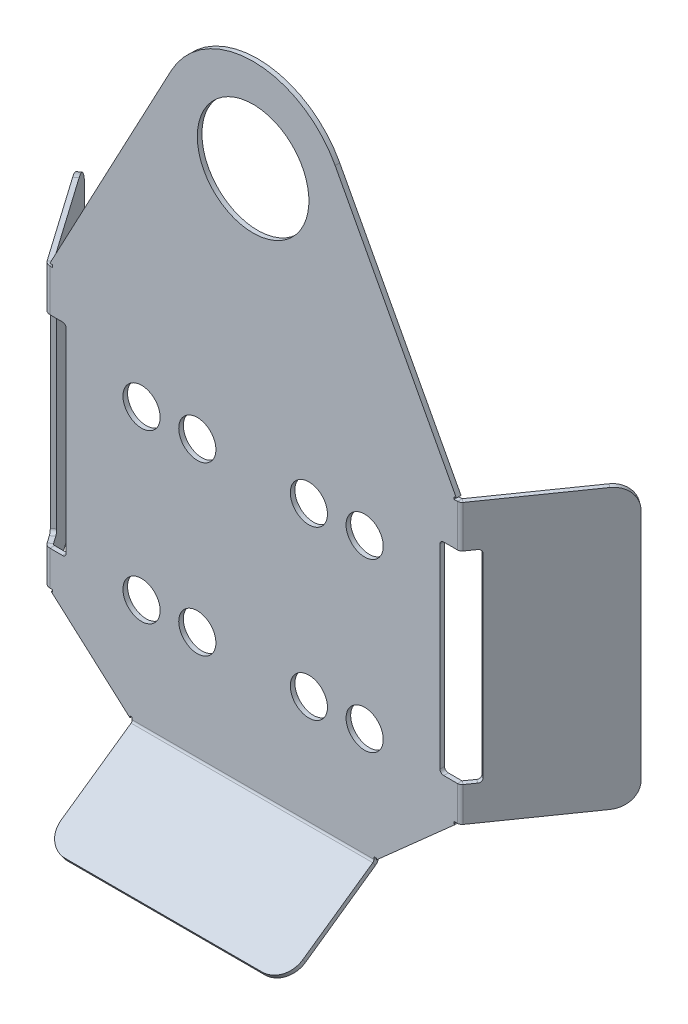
SolidWorks part; units mm, degrees
ref_plane "Front Plane" through (0, 0, 0) normal (0, 0, 1) x (1, 0, 0)
ref_plane "Top Plane" through (0, 0, 0) normal (0, 1, 0) x (1, 0, 0)
ref_plane "Right Plane" through (0, 0, 0) normal (1, 0, 0) x (0, 0, -1)
ref_plane "Plane1" through (0, 0, -1.2366) normal (0, 0, -1) x (-1, 0, 0)
sketch "Sketch7" plane through (0, 0, -1.2366) normal (0, 0, -1) x (-1, 0, 0)
  line L0 (-83.89, -54.5529) -> (-53.9983, -54.5529)
  line L1 (-53.9983, -54.5529) -> (-53.9983, -55.1712)
  line L2 (-53.9983, -55.1712) -> (-54.3044, -55.1712)
  line L3 (-54.3044, -55.1712) -> (-33.1183, -74.0033)
  line L4 (-33.1183, -74.0033) -> (-33.1183, -73.5511)
  line L5 (-33.1183, -73.5511) -> (-32.5, -73.5511)
  line L6 (-32.5, -73.5511) -> (-32.5, -98.4429)
  line L7 (-26.5, -104.4429) -> (26.5, -104.4429)
  line L8 (32.5, -98.4429) -> (32.5, -73.5511)
  line L9 (32.5, -73.5511) -> (33.1183, -73.5511)
  line L10 (33.1183, -73.5511) -> (33.1183, -74.0033)
  line L11 (33.1183, -74.0033) -> (54.3044, -55.1712)
  line L12 (54.3044, -55.1712) -> (53.9983, -55.1712)
  line L13 (53.9983, -55.1712) -> (53.9983, -54.5529)
  line L14 (53.9983, -54.5529) -> (83.89, -54.5529)
  line L15 (89.89, -48.5529) -> (89.89, 14.4471)
  line L16 (83.89, 20.4471) -> (53.9983, 20.4471)
  line L17 (53.9983, 20.4471) -> (53.9983, 21.0654)
  line L18 (53.9983, 21.0654) -> (54.6702, 21.0654)
  line L19 (54.6702, 21.0654) -> (22.0588, 82.2118)
  line L20 (-22.0588, 82.2118) -> (-54.6702, 21.0654)
  line L21 (-54.6702, 21.0654) -> (-53.9983, 21.0654)
  line L22 (-53.9983, 21.0654) -> (-53.9983, 20.4471)
  line L23 (-53.9983, 20.4471) -> (-83.89, 20.4471)
  line L24 (-89.89, 14.4471) -> (-89.89, -48.5529)
  arc A0 (-89.89, -48.5529) -> (-83.89, -54.5529) centre (-83.89, -48.5529) ccw
  arc A1 (-32.5, -98.4429) -> (-26.5, -104.4429) centre (-26.5, -98.4429) ccw
  arc A2 (26.5, -104.4429) -> (32.5, -98.4429) centre (26.5, -98.4429) ccw
  arc A3 (83.89, -54.5529) -> (89.89, -48.5529) centre (83.89, -48.5529) ccw
  arc A4 (89.89, 14.4471) -> (83.89, 20.4471) centre (83.89, 14.4471) ccw
  arc A5 (22.0588, 82.2118) -> (-22.0588, 82.2118) centre (0, 70.4471) ccw
  arc A6 (-83.89, 20.4471) -> (-89.89, 14.4471) centre (-83.89, 14.4471) ccw
sheet metal parameters "Sheet-Metal3" thickness 1.2366 parameters "D1"=0
base flange "Base-Flange1" sketch "Sketch7" thickness 1.2366 reverse thickness direction yes parameters "D1"=0
sketch "Sketch9" plane through (0, 0, -1.2366) normal (0, 0, -1) x (-1, 0, 0)
  line L0 (-50.2548, -44.2608) -> (-50.2548, 8.1212)
  line L1 (-51.2548, 9.1212) -> (-58.3864, 9.1212)
  line L2 (-59.3864, 8.1212) -> (-59.3864, -44.2608)
  line L3 (-58.3864, -45.2608) -> (-51.2548, -45.2608)
  arc A0 (-51.2548, -45.2608) -> (-50.2548, -44.2608) centre (-51.2548, -44.2608) ccw
  arc A1 (-50.2548, 8.1212) -> (-51.2548, 9.1212) centre (-51.2548, 8.1212) ccw
  arc A2 (-58.3864, 9.1212) -> (-59.3864, 8.1212) centre (-58.3864, 8.1212) ccw
  arc A3 (-59.3864, -44.2608) -> (-58.3864, -45.2608) centre (-58.3864, -44.2608) ccw
extrude "Cut-Extrude1" cut sketch "Sketch9" against normal through all
sketch "Sketch10" plane through (0, 0, 0) normal (0, 0, 1) x (1, 0, 0)
  line L0 (-50.2548, -44.2608) -> (-50.2548, 8.1212)
  line L1 (-51.2548, 9.1212) -> (-58.3864, 9.1212)
  line L2 (-59.3864, 8.1212) -> (-59.3864, -44.2608)
  line L3 (-58.3864, -45.2608) -> (-51.2548, -45.2608)
  arc A0 (-51.2548, -45.2608) -> (-50.2548, -44.2608) centre (-51.2548, -44.2608) ccw
  arc A1 (-50.2548, 8.1212) -> (-51.2548, 9.1212) centre (-51.2548, 8.1212) ccw
  arc A2 (-58.3864, 9.1212) -> (-59.3864, 8.1212) centre (-58.3864, 8.1212) ccw
  arc A3 (-59.3864, -44.2608) -> (-58.3864, -45.2608) centre (-58.3864, -44.2608) ccw
extrude "Cut-Extrude2" cut sketch "Sketch10" against normal through all
hole_wizard "Hole1" positions "Sketch12" profile "Sketch11" legacy
sketch "Sketch12" plane through (0, 0, -1.2366) normal (0, 0, -1) x (-1, 0, 0)
  point P0 (0, 70.4471)
sketch "Sketch11" plane through (0, 70.4471, -1.2366) normal (1, 0, 0) x (0, 1, 0)
  line L0 (0, 0) -> (0, 1.2366)
  line L1 (0, 1.2366) -> (15, 1.2366)
  line L2 (15, 1.2366) -> (15, 0)
  line L3 (15, 0) -> (0, 0)
  line L4 (0, 110) -> (0, -10) construction
  dimension "Diameter" = 30
  dimension "Depth" = 1.2366
hole_wizard "Hole2" positions "Sketch14" profile "Sketch13" legacy
sketch "Sketch14" plane through (0, 0, -1.2366) normal (0, 0, -1) x (-1, 0, 0)
  point P0 (-30, 0)
sketch "Sketch13" plane through (30, 0, -1.2366) normal (1, 0, 0) x (0, 1, 0)
  line L0 (0, 0) -> (0, 1.2366)
  line L1 (0, 1.2366) -> (5, 1.2366)
  line L2 (5, 1.2366) -> (5, 0)
  line L3 (5, 0) -> (0, 0)
  line L4 (0, 110) -> (0, -10) construction
  dimension "Diameter" = 10
  dimension "Depth" = 1.2366
hole_wizard "Hole3" positions "Sketch16" profile "Sketch15" legacy
sketch "Sketch16" plane through (0, 0, -1.2366) normal (0, 0, -1) x (-1, 0, 0)
  point P0 (-30, -45)
sketch "Sketch15" plane through (30, -45, -1.2366) normal (1, 0, 0) x (0, 1, 0)
  line L0 (0, 0) -> (0, 1.2366)
  line L1 (0, 1.2366) -> (5, 1.2366)
  line L2 (5, 1.2366) -> (5, 0)
  line L3 (5, 0) -> (0, 0)
  line L4 (0, 110) -> (0, -10) construction
  dimension "Diameter" = 10
  dimension "Depth" = 1.2366
hole_wizard "Hole4" positions "Sketch18" profile "Sketch17" legacy
sketch "Sketch18" plane through (0, 0, -1.2366) normal (0, 0, -1) x (-1, 0, 0)
  point P0 (-15, 0)
sketch "Sketch17" plane through (15, 0, -1.2366) normal (1, 0, 0) x (0, 1, 0)
  line L0 (0, 0) -> (0, 1.2366)
  line L1 (0, 1.2366) -> (5, 1.2366)
  line L2 (5, 1.2366) -> (5, 0)
  line L3 (5, 0) -> (0, 0)
  line L4 (0, 110) -> (0, -10) construction
  dimension "Diameter" = 10
  dimension "Depth" = 1.2366
hole_wizard "Hole5" positions "Sketch20" profile "Sketch19" legacy
sketch "Sketch20" plane through (0, 0, -1.2366) normal (0, 0, -1) x (-1, 0, 0)
  point P0 (-15, -45)
sketch "Sketch19" plane through (15, -45, -1.2366) normal (1, 0, 0) x (0, 1, 0)
  line L0 (0, 0) -> (0, 1.2366)
  line L1 (0, 1.2366) -> (5, 1.2366)
  line L2 (5, 1.2366) -> (5, 0)
  line L3 (5, 0) -> (0, 0)
  line L4 (0, 110) -> (0, -10) construction
  dimension "Diameter" = 10
  dimension "Depth" = 1.2366
hole_wizard "Hole6" positions "Sketch22" profile "Sketch21" legacy
sketch "Sketch22" plane through (0, 0, -1.2366) normal (0, 0, -1) x (-1, 0, 0)
  point P0 (15, 0)
sketch "Sketch21" plane through (-15, 0, -1.2366) normal (1, 0, 0) x (0, 1, 0)
  line L0 (0, 0) -> (0, 1.2366)
  line L1 (0, 1.2366) -> (5, 1.2366)
  line L2 (5, 1.2366) -> (5, 0)
  line L3 (5, 0) -> (0, 0)
  line L4 (0, 110) -> (0, -10) construction
  dimension "Diameter" = 10
  dimension "Depth" = 1.2366
hole_wizard "Hole7" positions "Sketch24" profile "Sketch23" legacy
sketch "Sketch24" plane through (0, 0, -1.2366) normal (0, 0, -1) x (-1, 0, 0)
  point P0 (15, -45)
sketch "Sketch23" plane through (-15, -45, -1.2366) normal (1, 0, 0) x (0, 1, 0)
  line L0 (0, 0) -> (0, 1.2366)
  line L1 (0, 1.2366) -> (5, 1.2366)
  line L2 (5, 1.2366) -> (5, 0)
  line L3 (5, 0) -> (0, 0)
  line L4 (0, 110) -> (0, -10) construction
  dimension "Diameter" = 10
  dimension "Depth" = 1.2366
hole_wizard "Hole8" positions "Sketch26" profile "Sketch25" legacy
sketch "Sketch26" plane through (0, 0, -1.2366) normal (0, 0, -1) x (-1, 0, 0)
  point P0 (30, 0)
sketch "Sketch25" plane through (-30, 0, -1.2366) normal (1, 0, 0) x (0, 1, 0)
  line L0 (0, 0) -> (0, 1.2366)
  line L1 (0, 1.2366) -> (5, 1.2366)
  line L2 (5, 1.2366) -> (5, 0)
  line L3 (5, 0) -> (0, 0)
  line L4 (0, 110) -> (0, -10) construction
  dimension "Diameter" = 10
  dimension "Depth" = 1.2366
hole_wizard "Hole9" positions "Sketch28" profile "Sketch27" legacy
sketch "Sketch28" plane through (0, 0, -1.2366) normal (0, 0, -1) x (-1, 0, 0)
  point P0 (30, -45)
sketch "Sketch27" plane through (-30, -45, -1.2366) normal (1, 0, 0) x (0, 1, 0)
  line L0 (0, 0) -> (0, 1.2366)
  line L1 (0, 1.2366) -> (5, 1.2366)
  line L2 (5, 1.2366) -> (5, 0)
  line L3 (5, 0) -> (0, 0)
  line L4 (0, 110) -> (0, -10) construction
  dimension "Diameter" = 10
  dimension "Depth" = 1.2366
sketch "Sketch29" plane through (0, 0, 0) normal (0, 0, 1) x (1, 0, 0)
  line L0 (-55.2669, -54.5529) -> (-55.2669, 20.4471)
sketched bend "Sketched Bend1" parameters "D1"=0.7366
bend "SketchBend1" bend radius 0.7366 bend angle 55 parameters "D5"=1
sketch "Sketch30" plane through (0, 0, 0) normal (0, 0, 1) x (1, 0, 0)
  line L2 (55.2669, -54.5529) -> (55.2669, 20.4471)
sketched bend "Sketched Bend2" parameters "D1"=0
bend "SketchBend4" bend radius 0 bend angle 55 parameters "D5"=2
sketch "Sketch31" plane through (0, 0, 0) normal (0, 0, 1) x (1, 0, 0)
  line L0 (-32.5, -74.8197) -> (32.5, -74.8197)
sketched bend "Sketched Bend3" parameters "D1"=0.7366
bend "SketchBend3" bend radius 0.7366 bend angle 55 parameters "D5"=3
flat pattern "Flat-Pattern3"
sketch "Bend-Lines3" plane through (0, 0, 0) normal (0, 0, 1) x (1, 0, 0)
  line L0 (-32.5, -74.8197) -> (32.5, -74.8197) construction
  line L1 (55.2669, -54.5529) -> (55.2669, 20.4471) construction
  line L2 (-55.2669, -54.5529) -> (-55.2669, 20.4471) construction
  line L6 (-32.5, -74.8197) -> (32.5, -74.8197) construction
  line L7 (55.2669, -54.5529) -> (55.2669, -45.2608) construction
  line L8 (55.2669, 9.1212) -> (55.2669, 20.4471) construction
  line L9 (-55.2669, -54.5529) -> (-55.2669, -45.2608) construction
  line L10 (-55.2669, 9.1212) -> (-55.2669, 20.4471) construction
sketch3d "Bounding-Box1" [suppressed]
  line L0 (-85.1739, -92.3659, 0) -> (39.9815, 30.9793, 0) construction
  line L1 (-207.7614, 32.0207, 0) -> (-82.6061, 155.3659, 0) construction
  line L2 (-85.1739, -92.3659, 0) -> (-207.7614, 32.0207, 0) construction
  line L3 (39.9815, 30.9793, 0) -> (-82.6061, 155.3659, 0) construction
bend of the flat pattern "Flatten-<SketchBend1>1" [suppressed]
bend of the flat pattern "Flatten-<SketchBend4>1" [suppressed]
bend of the flat pattern "Flatten-<SketchBend3>1" [suppressed]
